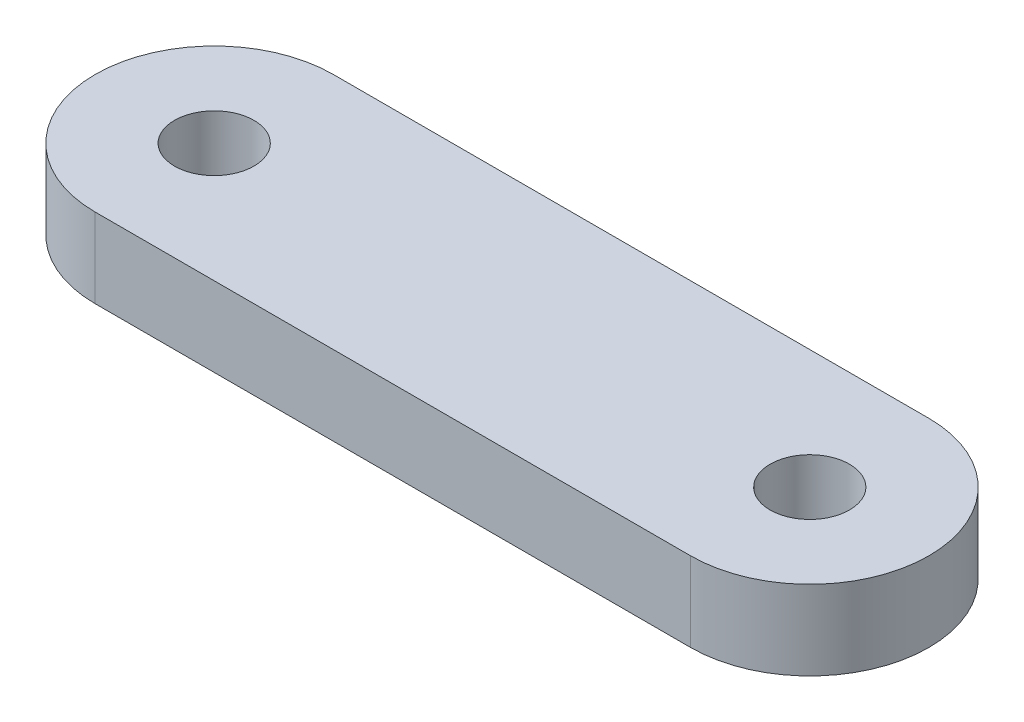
SolidWorks part; units mm, degrees
ref_plane "Front Plane" through (0, 0, 0) normal (0, 0, 1) x (1, 0, 0)
ref_plane "Top Plane" through (0, 0, 0) normal (0, 1, 0) x (1, 0, 0)
ref_plane "Right Plane" through (0, 0, 0) normal (1, 0, 0) x (0, 0, -1)
sketch "Sketch1" plane through (0, 0, 0) normal (0, 1, 0) x (1, 0, 0)
  line L0 (-7.5, 0) -> (7.5, 0) construction
  line L1 (-7.5, -3) -> (7.5, -3)
  line L2 (-7.5, 3) -> (7.5, 3)
  line L3 (-7.5, 0) -> (7.5, 0) construction
  arc A0 (-7.5, -3) -> (-7.5, 3) centre (-7.5, 0) cw
  arc A1 (7.5, -3) -> (7.5, 3) centre (7.5, 0) ccw
  circle A2 centre (-7.5, 0) radius 1
  circle A3 centre (7.5, 0) radius 1
  point P2 (0, 0)
  point P12 (0, 0)
  dimension "Pin diameter" = 2
  dimension "D1" = 15
  dimension "D2" = 3
  dimension "D3" = 3
extrude "Extrude1" add sketch "Sketch1" along normal blind 2
